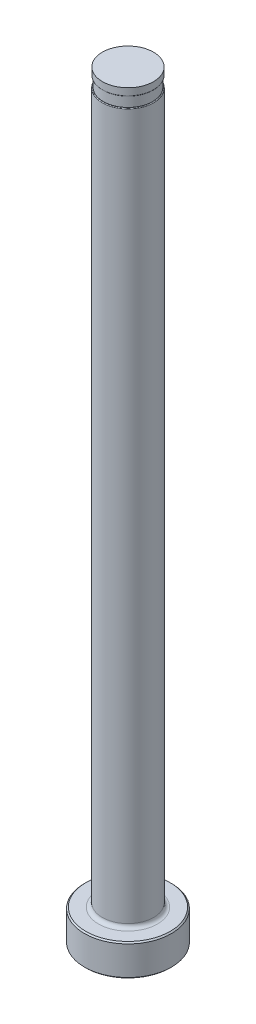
SolidWorks part; units mm, degrees
ref_plane "Front Plane" through (0, 0, 0) normal (0, 0, 1) x (1, 0, 0)
ref_plane "Top Plane" through (0, 0, 0) normal (0, 1, 0) x (1, 0, 0)
ref_plane "Right Plane" through (0, 0, 0) normal (1, 0, 0) x (0, 0, -1)
other "Configuration Table"
sketch "Sketch1" plane through (0, 0, 0) normal (0, 0, 1) x (1, 0, 0)
  line L0 (0, 259.9588) -> (0, -15.1925) construction
  line L1 (0, 0) -> (-8.7249, 0)
  line L2 (-8.7249, 0) -> (-8.7249, 6.35)
  line L3 (-8.7249, 6.35) -> (-5.1587, 6.35)
  line L4 (-5.1587, 6.35) -> (-5.1587, 152.4)
  line L5 (-5.1587, 152.4) -> (0, 152.4)
  line L6 (0, 152.4) -> (0, 0)
  dimension "L" = 152.4
  dimension "H" = 17.4498
  dimension "T" = 6.35
  dimension "D" = 10.3175
revolve "Revolve1" add sketch "Sketch1" angle 360 about L0
chamfer "Chamfer1" distance 0.254 angle 45 2 edges at (0, 6.35, 8.7249) (0, 0, 8.7249)
fillet "Fillet1" radius 0.762 1 edges at (0, 6.35, 5.1587)
sketch "Sketch2" plane through (0, 0, 0) normal (0, 0, 1) x (1, 0, 0)
  line L0 (-5.1587, 152.4) -> (-5.1587, 7.112) construction
  line L1 (-5.1587, 150.876) -> (-4.9555, 150.876)
  line L2 (-5.1587, 150.876) -> (-5.1587, 148.844)
  line L3 (-5.1587, 148.844) -> (-4.9555, 148.844)
  line L4 (-4.9555, 150.876) -> (-4.9555, 148.844)
  line L5 (5.1587, 152.4) -> (-5.1587, 152.4) construction
  line L6 (0, 153.4483) -> (0, 147.3282) construction
  dimension "D1" = 2.032
  dimension "N" = 1.524
  dimension "FD" = 0.2032
  dimension "D3" = 9.9111
revolve "Vent Relief" cut sketch "Sketch2" angle 360 about L6
sketch "Sketch3" plane through (0, 0, 0) normal (0, 0, 1) x (1, 0, 0)
  line L0 (-4.9555, 149.86) -> (-4.9555, 86.36)
  line L1 (-4.9555, 150.876) -> (-4.9555, 148.844) construction
  line L2 (-5.1587, 148.844) -> (-5.1587, 7.112) construction
  line L3 (-5.1587, 85.2424) -> (-5.1587, 149.86)
  line L4 (-5.1587, 149.86) -> (-4.9555, 149.86)
  arc A0 (-4.9555, 86.36) -> (-5.1587, 85.2424) centre (-8.1305, 86.36) cw
  dimension "D1" = 3.175
  dimension "D2" = 63.5
extrude "D-Slot" cut sketch "Sketch3" against normal through all both and the other way through all
sketch "Sketch5" plane through (0, 0, 0) normal (0, 0, 1) x (1, 0, 0)
  line L0 (-5.1587, 150.876) -> (5.1587, 150.876) construction
  line L1 (-5.1587, 152.4) -> (-5.1333, 152.4)
  line L2 (-5.1587, 152.4) -> (-5.1587, 150.876)
  line L3 (-5.1587, 150.876) -> (-5.1333, 150.876)
  line L4 (-5.1333, 152.4) -> (-5.1333, 150.876)
  line L5 (0, 152.6877) -> (0, 150.5771) construction
  dimension "VP" = 0.0254
revolve "Vent Diameter" cut sketch "Sketch5" angle 360 about L5
fillet "Fillet2" radius 0.127 2 edges at (5.1587, 148.844, 0) (0, 150.876, 5.1333)
sketch "Pocket Sketch" plane through (0, 0, 0) normal (0, 0, 1) x (1, 0, 0)
  line L0 (-9.1218, 0) -> (-9.1218, 6.3754)
  line L1 (-9.1218, 6.3754) -> (-6.1192, 6.3754)
  line L2 (-5.3572, 7.1374) -> (-5.3572, 22.225)
  line L3 (-5.3572, 22.225) -> (0, 22.225)
  line L4 (0, 22.225) -> (0, 0)
  line L5 (0, 0) -> (-9.1218, 0)
  line L6 (0, 12.6104) -> (0, -2.4989) construction
  line L7 (-8.7249, 6.096) -> (-8.7249, 0.254) construction
  line L8 (8.4709, 6.35) -> (-8.4709, 6.35) construction
  line L9 (-5.1587, 85.2424) -> (-5.1587, 7.112) construction
  line L10 (-6.1192, 6.3754) -> (-5.3572, 7.1374)
  point P3 (-5.3572, 6.3754)
  dimension "D1" = 18.2435
  dimension "D2" = 0.3969
  dimension "D3" = 0.0254
  dimension "D4" = 0.1984
  dimension "D5" = 10.7144
  dimension "D6" = 22.225
